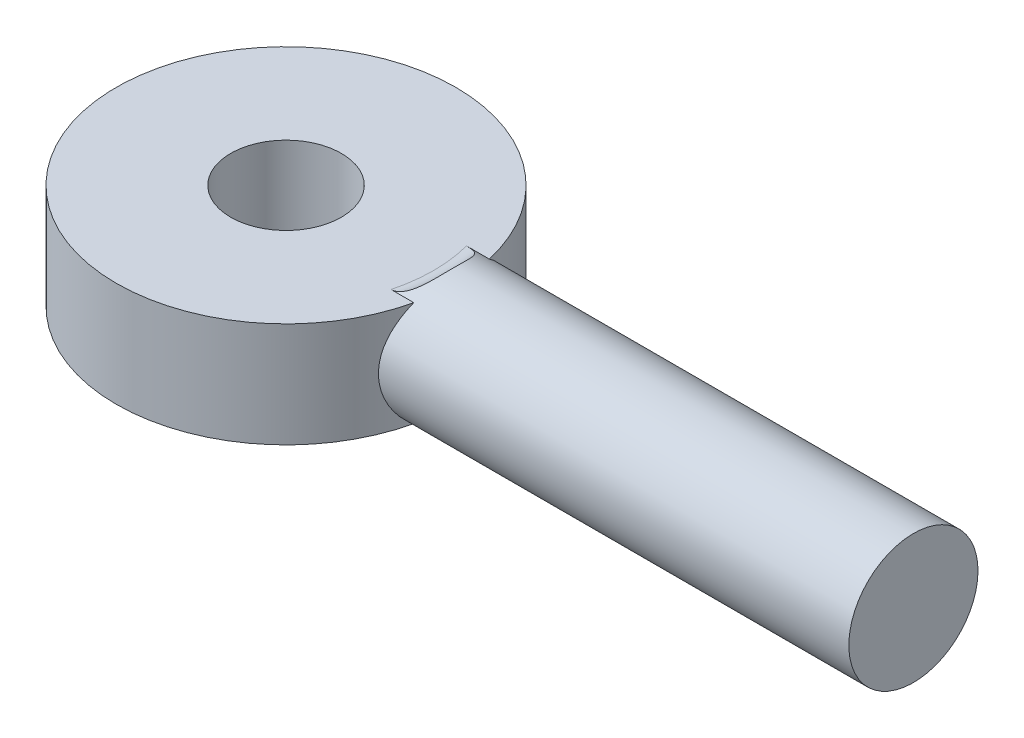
SolidWorks part; units mm, degrees
ref_plane "Front Plane" through (0, 0, 0) normal (0, 0, 1) x (1, 0, 0)
ref_plane "Top Plane" through (0, 0, 0) normal (0, 1, 0) x (1, 0, 0)
ref_plane "Right Plane" through (0, 0, 0) normal (1, 0, 0) x (0, 0, -1)
sketch "Sketch1" plane through (0, 0, 0) normal (0, 1, 0) x (1, 0, 0)
  circle A0 centre (0, 0) radius 14.605
  circle A1 centre (0, 0) radius 4.7625
  dimension "D1" = 29.21
  dimension "D2" = 9.525
extrude "Boss-Extrude1" add sketch "Sketch1" along normal mid plane 9.017 contours A0 | A1
ref_plane "Plane1" through (53.975, 0, 0) normal (1, 0, 0) x (0, 0, -1)
sketch "Sketch2" plane through (53.975, 0, 0) normal (1, 0, 0) x (0, 0, -1)
  circle A0 centre (0, 0) radius 5.5562
  dimension "D1" = 11.1125
extrude "Boss-Extrude2" add sketch "Sketch2" against normal up to surface (40.4682 mm away) contours A0
fillet "Fillet1" radius 1.905 2 edges at (14.605, -4.5085, 0) (14.605, 4.5085, 0)
sketch "Sketch4" plane through (0, 0, 0) normal (0, 0, 1) x (1, 0, 0)
  line L0 (0, -17.195) -> (0, 21.6595) construction
  point P4 (0, 0)
